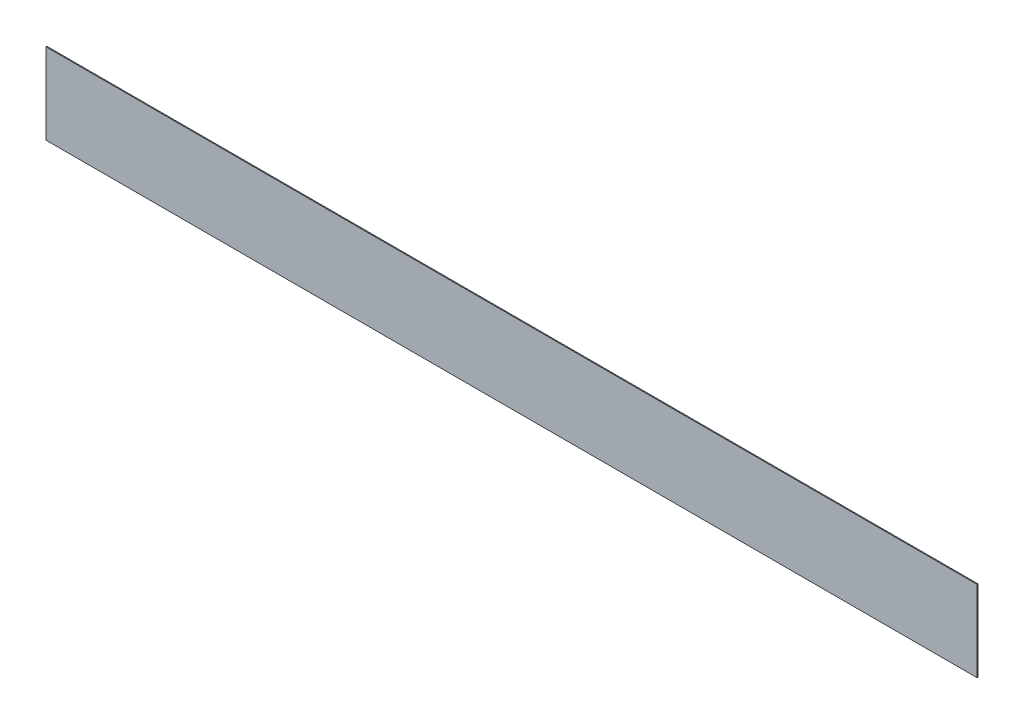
SolidWorks part; units mm, degrees
ref_plane "Front Plane" through (0, 0, 0) normal (0, 0, 1) x (1, 0, 0)
ref_plane "Top Plane" through (0, 0, 0) normal (0, 1, 0) x (1, 0, 0)
ref_plane "Right Plane" through (0, 0, 0) normal (1, 0, 0) x (0, 0, -1)
sketch "Sketch1" plane through (0, 0, 0) normal (0, 0, 1) x (1, 0, 0)
  line L1 (0, 0) -> (2047.24, 0)
  line L2 (0, 0) -> (0, 177.8)
  line L3 (0, 177.8) -> (2047.24, 177.8)
  line L4 (2047.24, 0) -> (2047.24, 177.8)
  dimension "D1" = 177.8
  dimension "D2" = 2047.24
extrude "Boss-Extrude1" add sketch "Sketch1" along normal blind 2.032
